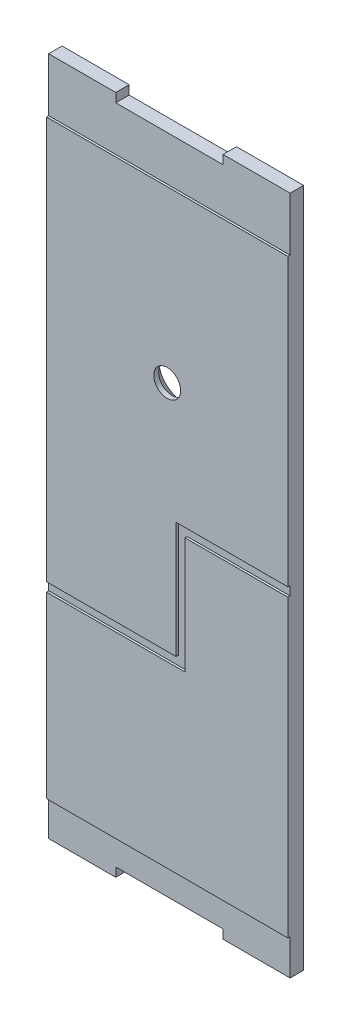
SolidWorks part; units mm, degrees
ref_plane "Спереди" through (0, 0, 0) normal (0, 0, 1) x (1, 0, 0)
ref_plane "Сверху" through (0, 0, 0) normal (0, 1, 0) x (1, 0, 0)
ref_plane "Справа" through (0, 0, 0) normal (1, 0, 0) x (0, 0, -1)
sketch "Эскиз1" plane through (0, 0, 0) normal (0, 0, 1) x (1, 0, 0)
  line L1 (0, 0) -> (27, 0)
  line L2 (0, 0) -> (0, 76)
  line L3 (0, 76) -> (27, 76)
  line L4 (27, 0) -> (27, 76)
  dimension "D1" = 27
  dimension "D2" = 76
extrude "Бобышка-Вытянуть1" add sketch "Эскиз1" along normal blind 1.5
sketch "Эскиз3" plane through (0, 0, 1.5) normal (0, 0, 1) x (1, 0, 0)
  line L4 (0, 76) -> (0, 0)
  line L5 (0, 0) -> (27, 0)
  line L6 (27, 0) -> (27, 76)
  line L7 (27, 76) -> (0, 76)
  line L8 (0, 76) -> (0, 0)
  line L9 (0, 0) -> (27, 0)
  line L10 (27, 0) -> (27, 76)
  line L11 (27, 76) -> (0, 76)
  dimension "D1" = 0
extrude "Бобышка-Вытянуть2" add sketch "Эскиз3" along normal blind 0.25
sketch "Эскиз5" plane through (0, 0, 1.75) normal (0, 0, 1) x (1, 0, 0)
  line L0 (27, 0) -> (27, 76) construction
  line L1 (0, 76) -> (27, 76)
  line L2 (0, 76) -> (0, 70)
  line L3 (0, 70) -> (27, 70)
  line L4 (27, 76) -> (27, 70)
  line L6 (0, 0) -> (27, 0)
  line L7 (0, 0) -> (0, 4)
  line L8 (0, 4) -> (27, 4)
  line L9 (27, 0) -> (27, 4)
  dimension "D1" = 6
  dimension "D2" = 4
extrude "Вырез-Вытянуть1" cut sketch "Эскиз5" against normal blind 0.25
sketch "Эскиз6" plane through (0, 0, 1.75) normal (0, 0, 1) x (1, 0, 0)
  line L0 (13.5, 76) -> (13.5, 0) construction
  line L1 (27, 76) -> (0, 76) construction
  line L2 (0, 0) -> (27, 0) construction
  circle A0 centre (13.5, 51) radius 1.5
  dimension "D1" = 3
  dimension "D2" = 25
extrude "Вырез-Вытянуть2" cut sketch "Эскиз6" against normal through all
sketch "Эскиз7" plane through (0, 0, 1.75) normal (0, 0, 1) x (1, 0, 0)
  line L0 (0, 70) -> (0, 4) construction
  line L1 (14.5, 38) -> (27, 38)
  line L2 (27, 38) -> (27, 37)
  line L3 (15.5, 24) -> (0, 24)
  line L5 (27, 4) -> (27, 70) construction
  line L6 (13.5, 51) -> (13.5, 25) construction
  line L7 (0, 25) -> (12.5, 25)
  line L11 (15.5, 37) -> (15.5, 24)
  line L12 (12.5, 25) -> (14.5, 25)
  line L13 (14.5, 38) -> (14.5, 25)
  line L14 (15.5, 37) -> (27, 37)
  line L17 (0, 25) -> (0, 24)
  circle A0 centre (13.5, 51) radius 1.5 construction
  dimension "D1" = 1
  dimension "D2" = 1
  dimension "D3" = 2
  dimension "D4" = 1
  dimension "D5" = 14
  dimension "D6" = 13
extrude "Вырез-Вытянуть3" cut sketch "Эскиз7" against normal blind 0.25
sketch "Эскиз8" plane through (0, 0, 1.5) normal (0, 0, 1) x (1, 0, 0)
  line L0 (13.5, 76) -> (13.5, 0) construction
  line L1 (27, 76) -> (0, 76) construction
  line L2 (0, 0) -> (27, 0) construction
  line L4 (7.5, 76) -> (19.5, 76)
  line L5 (7.5, 76) -> (7.5, 75)
  line L6 (7.5, 75) -> (19.5, 75)
  line L7 (19.5, 76) -> (19.5, 75)
  line L8 (7.5, 0) -> (19.5, 0)
  line L9 (7.5, 0) -> (7.5, 1)
  line L10 (7.5, 1) -> (19.5, 1)
  line L11 (19.5, 0) -> (19.5, 1)
  dimension "D1" = 12
  dimension "D2" = 1
  dimension "D3" = 1
  dimension "D4" = 12
extrude "Вырез-Вытянуть4" cut sketch "Эскиз8" against normal through all
chamfer "Фаска1" distance 1.2 angle 45 1 edges at (15, 51, 0)
